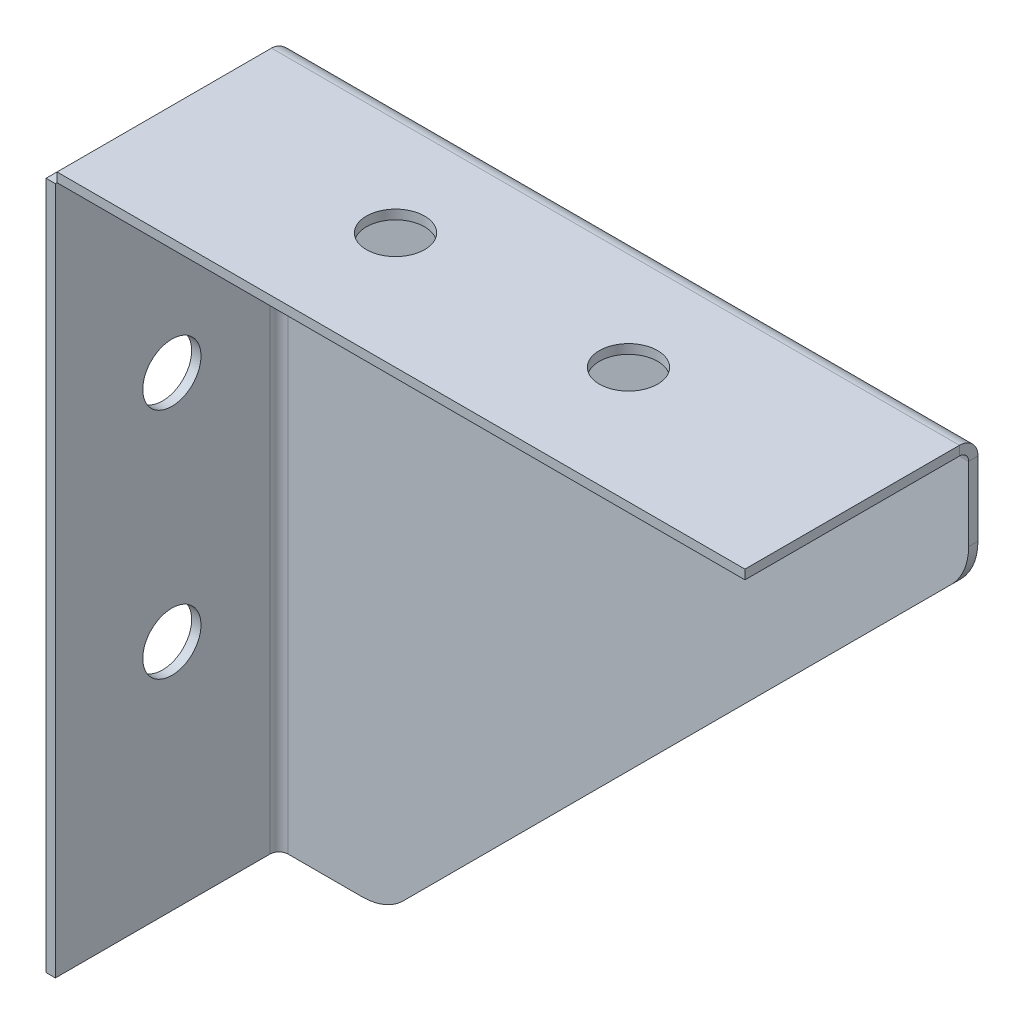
SolidWorks part; units mm, degrees
ref_plane "Front Plane" through (0, 0, 0) normal (0, 0, 1) x (1, 0, 0)
ref_plane "Top Plane" through (0, 0, 0) normal (0, 1, 0) x (1, 0, 0)
ref_plane "Right Plane" through (0, 0, 0) normal (1, 0, 0) x (0, 0, -1)
sketch "Sketch1" plane through (0, 0, 0) normal (0, 0, 1) x (1, 0, 0)
  line L0 (0, 0) -> (76.2, 0)
  line L1 (76.2, 0) -> (76.2, -12.7)
  line L2 (0, -76.2) -> (0, 0)
  line L3 (76.2, -12.7) -> (12.7, -76.2)
  line L4 (12.7, -76.2) -> (0, -76.2)
  dimension "D1" = 76.2
  dimension "D2" = 12.7
sheet metal parameters "Sheet-Metal1" thickness 1.016 parameters "D1"=1
base flange "Base-Flange1" sketch "Sketch1" thickness 1.016 reverse thickness direction yes parameters "D1"=1
ref_plane "Plane1" through (76.2, 0, 0) normal (-1, 0, 0) x (0, 0, 1)
sketch "Sketch3" plane through (76.2, 0, 0) normal (-1, 0, 0) x (0, 0, 1)
  line L0 (0, 0) -> (25.4, 0)
  dimension "D1" = 25.4
miter flange "Miter Flange1" parameters "D1"=1
bend "Miterbend1" bend radius 1 bend angle 90 parameters "D5"=1
bend "Miterbend2" bend radius 1 bend angle 90 parameters "D5"=2
break corner "Break-Corner1" thickness 1.016 parameters "D1"=2000, "D0"=6.35, "D7"=5
hole_wizard "1/4 (0.25) Diameter Hole1" positions "Sketch5" profile "Sketch4" hole size "1/4" standard "Ansi Inch"
sketch "Sketch5" plane through (0, 0, 0) normal (0, 1, 0) x (-1, 0, 0)
  line L0 (-1.1956, 12.7) -> (-76.2, 12.7) construction
  line L2 (-76.2, 25.4) -> (-76.2, 2.016) construction
  line L3 (0, 25.4) -> (0, 2.016) construction
  line L4 (-76.2, 25.4) -> (-1.1956, 25.4) construction
  point P0 (-25.4, 12.7)
  point P1 (-50.8, 12.7)
  dimension "D1" = 25.4
  dimension "D2" = 25.4
  dimension "D3" = 12.7
sketch "Sketch4" plane through (25.4, 0, 12.7) normal (1, 0, 0) x (0, 0, 1)
  line L0 (0, 0) -> (0, 27.3077)
  line L1 (0, 27.3077) -> (3.175, 25.4)
  line L2 (3.175, 25.4) -> (3.175, 0)
  line L5 (3.175, 0) -> (0, 0)
  line L10 (0, 27.3077) -> (-3.175, 25.4) construction
  line L11 (0, -6.35) -> (0, 107.95) construction
  dimension "Hole Dia." = 6.35
  dimension "Hole Depth" = 25.4
  dimension "Drill Angle" = 118
hole_wizard "1/4 (0.25) Diameter Hole2" positions "Sketch6" profile "Sketch7" hole size "1/4" standard "Ansi Inch"
sketch "Sketch6" plane through (0, -27.7192, 32.2475) normal (-1, 0, 0) x (0, 0, 1)
  line L0 (-19.5475, -48.4808) -> (-19.5475, 27.7192) construction
  line L1 (-6.8475, 26.5236) -> (-6.8475, -48.4808) construction
  line L4 (-30.2315, -48.4808) -> (-6.8475, -48.4808) construction
  line L5 (-30.2315, 27.7192) -> (-6.8475, 27.7192) construction
  point P0 (-19.5475, -23.0808)
  point P1 (-19.5475, 2.3192)
  dimension "D1" = 25.4
  dimension "D2" = 25.4
  dimension "D3" = 12.7
sketch "Sketch7" plane through (0, -50.8, 12.7) normal (0, 1, 0) x (0, 0, 1)
  line L0 (0, 0) -> (0, 27.3077)
  line L1 (0, 27.3077) -> (3.175, 25.4)
  line L2 (3.175, 25.4) -> (3.175, 0)
  line L5 (3.175, 0) -> (0, 0)
  line L10 (0, 27.3077) -> (-3.175, 25.4) construction
  line L11 (0, -6.35) -> (0, 107.95) construction
  dimension "Hole Dia." = 6.35
  dimension "Hole Depth" = 25.4
  dimension "Drill Angle" = 118
flat pattern "Flat-Pattern1"
sketch "Bend-Lines1" plane through (0, 0, 1.016) normal (0, 0, 1) x (1, 0, 0)
  line L0 (0.8316, -76.2) -> (0.8316, -1.1956) construction
  line L1 (1.1956, -0.8316) -> (76.2, -0.8316) construction
  line L2 (0.8316, -76.2) -> (0.8316, -1.1956) construction
  line L3 (1.1956, -0.8316) -> (76.2, -0.8316) construction
sketch3d "Bounding-Box1" [suppressed]
  line L0 (76.2, -76.2, 0) -> (76.2, 23.7368, 0) construction
  line L1 (-23.7368, -76.2, 0) -> (-23.7367, 23.7368, 0) construction
  line L2 (76.2, -76.2, 0) -> (-23.7368, -76.2, 0) construction
  line L3 (76.2, 23.7368, 0) -> (-23.7367, 23.7368, 0) construction
bend of the flat pattern "Flatten-<Miterbend1>1"
bend of the flat pattern "Flatten-<Miterbend2>1"
